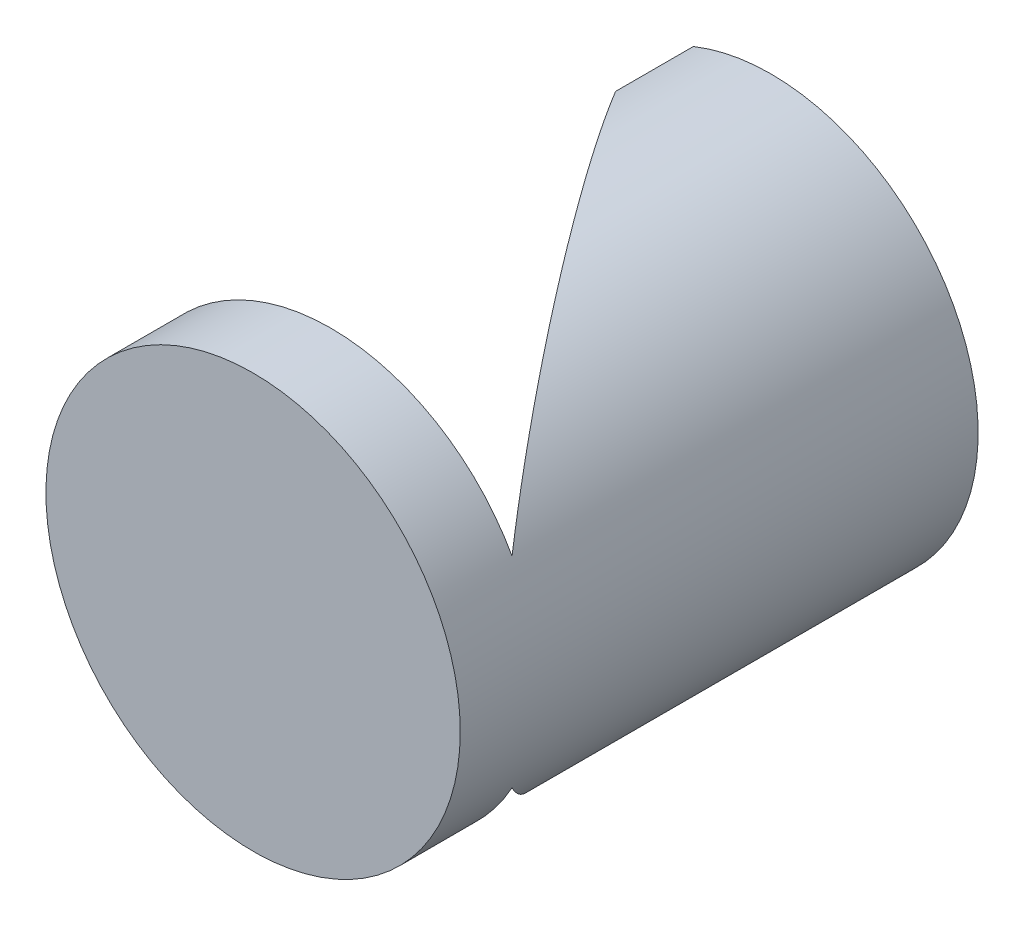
SolidWorks part; units mm, degrees
ref_plane "前视基准面" through (0, 0, 0) normal (0, 0, 1) x (1, 0, 0)
ref_plane "上视基准面" through (0, 0, 0) normal (0, 1, 0) x (1, 0, 0)
ref_plane "右视基准面" through (0, 0, 0) normal (1, 0, 0) x (0, 0, -1)
other "Configuration Table"
sketch "草图1" plane through (0, 0, 0) normal (0, 0, 1) x (1, 0, 0)
  circle A0 centre (0, 0) radius 40
extrude "凸台-拉伸2" add sketch "草图1" along normal blind 100
sketch "草图3" plane through (0, 0, 0) normal (0, 1, 0) x (1, 0, 0)
  line L0 (-40, 0) -> (-15, 0)
  line L1 (40, 0) -> (-40, 0) construction
  line L2 (-15, 0) -> (-15, -15)
  line L3 (-40, 0) -> (-40, -85)
  line L4 (-40, 0) -> (-40, -100) construction
  line L5 (-40, -85) -> (35, -85)
  line L6 (-15, -15) -> (35, -85)
extrude "切除-拉伸2" cut sketch "草图3" along normal through all and the other way through all
